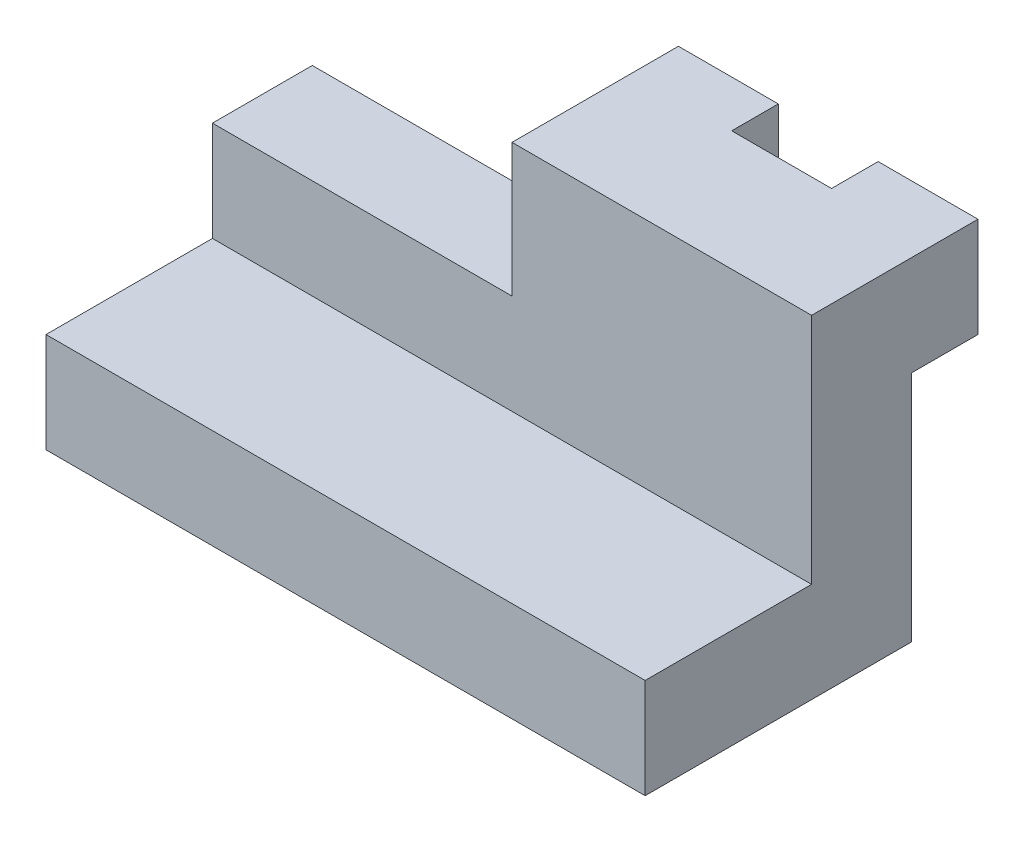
SolidWorks part; units mm, degrees
ref_plane "前视基准面" through (0, 0, 0) normal (0, 0, 1) x (1, 0, 0)
ref_plane "上视基准面" through (0, 0, 0) normal (0, 1, 0) x (1, 0, 0)
ref_plane "右视基准面" through (0, 0, 0) normal (1, 0, 0) x (0, 0, -1)
sketch "草图1" plane through (0, 0, 0) normal (0, 1, 0) x (1, 0, 0)
  line L1 (0, 0) -> (90, 0)
  line L2 (0, 0) -> (0, 40)
  line L3 (0, 40) -> (90, 40)
  line L4 (90, 0) -> (90, 40)
  dimension "D1" = 40
  dimension "D2" = 90
extrude "拉伸1" add sketch "草图1" along normal blind 15
sketch "草图2" plane through (0, 15, 0) normal (0, 1, 0) x (1, 0, 0)
  line L0 (90, 0) -> (90, 40) construction
  line L1 (0, 40) -> (90, 40)
  line L2 (0, 40) -> (0, 25)
  line L3 (0, 25) -> (90, 25)
  line L4 (90, 40) -> (90, 25)
  dimension "D1" = 15
extrude "拉伸2" add sketch "草图2" along normal blind 15
sketch "草图3" plane through (0, 30, 0) normal (0, 1, 0) x (1, 0, 0)
  line L0 (90, 40) -> (0, 40) construction
  line L1 (45, 40) -> (90, 40)
  line L2 (45, 40) -> (45, 25)
  line L3 (45, 25) -> (90, 25)
  line L4 (90, 40) -> (90, 25)
extrude "拉伸3" add sketch "草图3" along normal blind 5
sketch "草图4" plane through (0, 35, 0) normal (0, 1, 0) x (1, 0, 0)
  line L0 (45, 25) -> (45, 50)
  line L1 (45, 50) -> (60, 50)
  line L2 (60, 50) -> (60, 43)
  line L3 (60, 43) -> (75, 43)
  line L4 (75, 43) -> (75, 50)
  line L5 (75, 50) -> (90, 50)
  line L6 (90, 50) -> (90, 25)
  line L7 (67.5, 25) -> (67.5, 15.2586) construction
  line L8 (45, 25) -> (90, 25) construction
  line L9 (45, 25) -> (90, 25)
  dimension "D1" = 15
  dimension "D2" = 25
  dimension "D3" = 18
extrude "拉伸4" add sketch "草图4" along normal blind 15
